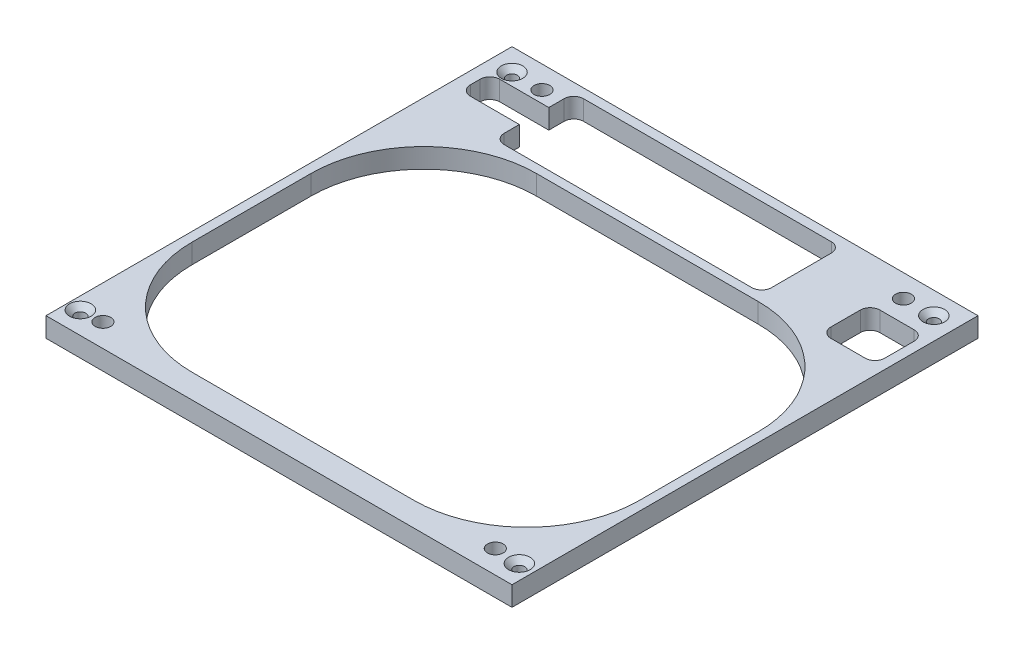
SolidWorks part; units mm, degrees
ref_plane "Front Plane" through (0, 0, 0) normal (0, 0, 1) x (1, 0, 0)
ref_plane "Top Plane" through (0, 0, 0) normal (0, 1, 0) x (1, 0, 0)
ref_plane "Right Plane" through (0, 0, 0) normal (1, 0, 0) x (0, 0, -1)
sketch "Sketch1" plane through (0, 0, 0) normal (0, 1, 0) x (1, 0, 0)
  line L1 (47.5, 47.5) -> (-47.5, 47.5)
  line L2 (47.5, 47.5) -> (47.5, -47.5)
  line L3 (47.5, -47.5) -> (-47.5, -47.5)
  line L4 (-47.5, 47.5) -> (-47.5, -47.5)
  line L5 (47.5, 47.5) -> (-47.5, -47.5) construction
  line L6 (47.5, -47.5) -> (-47.5, 47.5) construction
  point P0 (0, 0)
  dimension "D1" = 95
  dimension "D2" = 95
extrude "Boss-Extrude1" add sketch "Sketch1" along normal blind 4
sketch "Sketch2" plane through (0, 4, 0) normal (0, 1, 0) x (1, 0, 0)
  line L0 (-47.5, 47.5) -> (-47.5, -47.5) construction
  line L1 (-22.6, 27.6) -> (22.6, 27.6)
  line L2 (-45.6, 4.6) -> (-45.6, -19.6)
  line L3 (-22.6, -42.6) -> (22.6, -42.6)
  line L4 (45.6, 4.6) -> (45.6, -19.6)
  line L5 (47.5, -47.5) -> (47.5, 47.5) construction
  line L6 (-47.5, -47.5) -> (47.5, -47.5) construction
  line L7 (47.5, 47.5) -> (-47.5, 47.5) construction
  line L8 (-33, 43.6) -> (-33, 40.5)
  line L9 (-31, 45.6) -> (19.5, 45.6)
  line L10 (-45, 38.5) -> (-45, 36.5)
  line L11 (-31, 29.4) -> (19.5, 29.4)
  line L12 (21.5, 43.6) -> (21.5, 31.4)
  line L13 (-33, 40.5) -> (-43, 40.5)
  line L14 (-33, 31.4) -> (-33, 34.5)
  line L15 (-33, 34.5) -> (-43, 34.5)
  arc A0 (-45.6, -19.6) -> (-22.6, -42.6) centre (-22.6, -19.6) ccw
  arc A1 (22.6, -42.6) -> (45.6, -19.6) centre (22.6, -19.6) ccw
  arc A2 (22.6, 27.6) -> (45.6, 4.6) centre (22.6, 4.6) cw
  arc A3 (-45.6, 4.6) -> (-22.6, 27.6) centre (-22.6, 4.6) cw
  arc A4 (19.5, 45.6) -> (21.5, 43.6) centre (19.5, 43.6) cw
  arc A5 (19.5, 29.4) -> (21.5, 31.4) centre (19.5, 31.4) ccw
  arc A6 (-43, 40.5) -> (-45, 38.5) centre (-43, 38.5) ccw
  arc A7 (-43, 34.5) -> (-45, 36.5) centre (-43, 36.5) cw
  arc A8 (-33, 31.4) -> (-31, 29.4) centre (-31, 31.4) ccw
  arc A9 (-33, 43.6) -> (-31, 45.6) centre (-31, 43.6) cw
  point P34 (-45, 40.5)
  point P39 (-33, 29.4)
  dimension "D5" = 23
  dimension "D10" = 2
  dimension "D14" = 2
  dimension "D15" = 2
  dimension "D1" = 1.9
  dimension "D2" = 1.9
  dimension "D3" = 4.9
  dimension "D4" = 19.9
  dimension "D6" = 1.9
  dimension "D7" = 1.8
  dimension "D8" = 2.5
  dimension "D9" = 26
  dimension "D11" = 5.1
  dimension "D12" = 12
  dimension "D13" = 5.1
  dimension "D16" = 6
extrude "Cut-Extrude1" cut sketch "Sketch2" against normal through all
hole_wizard "Ø3.2 (3.2) Diameter Hole1" positions "Sketch4" profile "Sketch3" hole size "Ø3.2" standard "ISO"
sketch "Sketch4" plane through (0, 4, 0) normal (0, 1, 0) x (1, 0, 0)
  line L0 (-47.5, 47.5) -> (-47.5, -47.5) construction
  line L1 (47.5, 47.5) -> (-47.5, 47.5) construction
  line L2 (47.5, -47.5) -> (47.5, 47.5) construction
  line L3 (-47.5, -47.5) -> (47.5, -47.5) construction
  point P0 (-36.8, 42.9)
  point P2 (36.9, 42.9)
  point P4 (39.4, -42.8)
  point P6 (-40.6, -42.8)
  dimension "D1" = 10.7
  dimension "D2" = 4.6
  dimension "D3" = 10.6
  dimension "D4" = 4.6
  dimension "D5" = 8.1
  dimension "D6" = 4.7
  dimension "D7" = 4.7
  dimension "D8" = 6.9
sketch "Sketch3" plane through (-36.8, 4, -42.9) normal (1, 0, 0) x (0, 0, 1)
  line L0 (0, 0) -> (0, 4)
  line L1 (0, 4) -> (1.6, 4)
  line L2 (1.6, 4) -> (1.6, 0)
  line L5 (1.6, 0) -> (0, 0)
  line L11 (0, -6.35) -> (0, 107.95) construction
  dimension "Thru Hole Dia." = 3.2
  dimension "Thru Hole Depth" = 4
hole_wizard "CSK for M2 Countersunk Flat Head Screw1" positions "Sketch6" profile "Sketch5" countersink size "M2" standard "ISO"
sketch "Sketch6" plane through (0, 4, 0) normal (0, 1, 0) x (1, 0, 0)
  line L0 (-47.5, -47.5) -> (47.5, -47.5) construction
  line L1 (47.5, -47.5) -> (47.5, 47.5) construction
  line L2 (47.5, 47.5) -> (-47.5, 47.5) construction
  line L3 (-47.5, 47.5) -> (-47.5, -47.5) construction
  point P0 (-43, 43)
  point P2 (43, 43)
  point P4 (44.5, -43)
  point P6 (-45, -43)
  dimension "D1" = 4.5
  dimension "D2" = 3
  dimension "D3" = 4.5
  dimension "D4" = 4.5
  dimension "D5" = 4.5
  dimension "D6" = 4.5
  dimension "D7" = 4.5
  dimension "D8" = 2.5
sketch "Sketch5" plane through (-43, 4, -43) normal (1, 0, 0) x (0, 0, 1)
  line L0 (0, 0) -> (0, 4)
  line L1 (0, 4) -> (1.1, 4)
  line L2 (1.1, 4) -> (1.1, 1.1)
  line L3 (1.1, 1.1) -> (2.2, 0)
  line L5 (2.2, 0) -> (0, 0)
  line L6 (-1.1, 1.1) -> (-2.2, 0) construction
  line L11 (0, -6.35) -> (0, 107.95) construction
  dimension "Thru Hole Dia." = 2.2
  dimension "Thru Hole Depth" = 4
  dimension "Near C'Sink Dia." = 4.4
  dimension "Near C'Sink Angle" = 90
sketch "Sketch7" plane through (0, 4, 0) normal (0, 1, 0) x (1, 0, 0)
  line L0 (47.5, -47.5) -> (47.5, 47.5) construction
  line L1 (43.5, 38.5) -> (36.5, 38.5)
  line L2 (45.5, 36.5) -> (45.5, 30.5)
  line L3 (43.5, 28.5) -> (36.5, 28.5)
  line L4 (34.5, 36.5) -> (34.5, 30.5)
  line L5 (47.5, 47.5) -> (-47.5, 47.5) construction
  arc A0 (45.5, 30.5) -> (43.5, 28.5) centre (43.5, 30.5) cw
  arc A1 (43.5, 38.5) -> (45.5, 36.5) centre (43.5, 36.5) cw
  arc A2 (36.5, 38.5) -> (34.5, 36.5) centre (36.5, 36.5) ccw
  arc A3 (36.5, 28.5) -> (34.5, 30.5) centre (36.5, 30.5) cw
  point P10 (45.5, 28.5)
  point P13 (45.5, 38.5)
  dimension "D5" = 2
  dimension "D1" = 2
  dimension "D2" = 9
  dimension "D3" = 10
  dimension "D4" = 11
extrude "Cut-Extrude2" cut sketch "Sketch7" against normal through all
